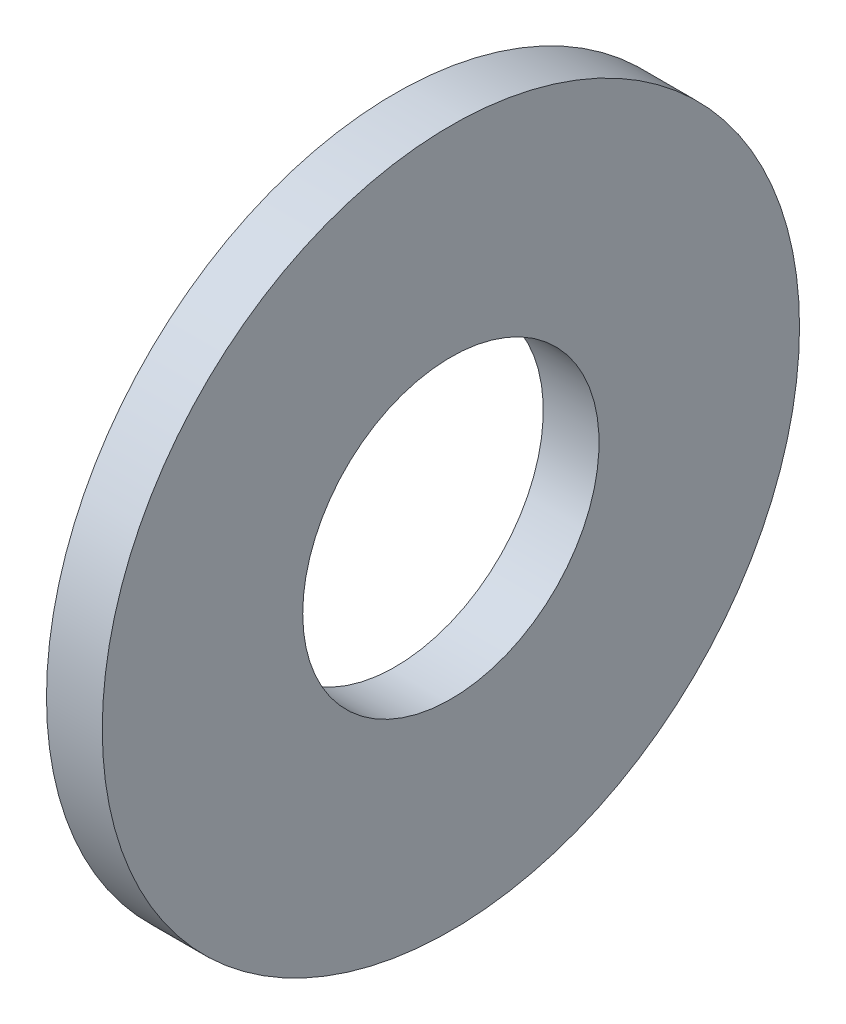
SolidWorks part; units mm, degrees
ref_plane "Plane1" through (0, 0, 0) normal (0, 0, 1) x (1, 0, 0)
ref_plane "Plane2" through (0, 0, 0) normal (0, 1, 0) x (1, 0, 0)
ref_plane "Plane3" through (0, 0, 0) normal (1, 0, 0) x (0, 0, -1)
revolve "Base-Revolve" add sketch "Sketch1" angle 360 about L0
sketch "Sketch1" plane through (0, 0, 0) normal (0, 0, 1) x (1, 0, 0)
  line L0 (-34.925, 0) -> (9.525, 0) construction
  line L1 (0, 2.125) -> (0, 5)
  line L2 (0, 5) -> (-0.8, 5)
  line L3 (-0.8, 5) -> (-0.8, 2.125)
  line L4 (-0.8, 2.125) -> (0, 2.125)
  dimension "Thickness" = 0.8
  dimension "Inside_dia" = 4.25
  dimension "Outside_dia" = 10
